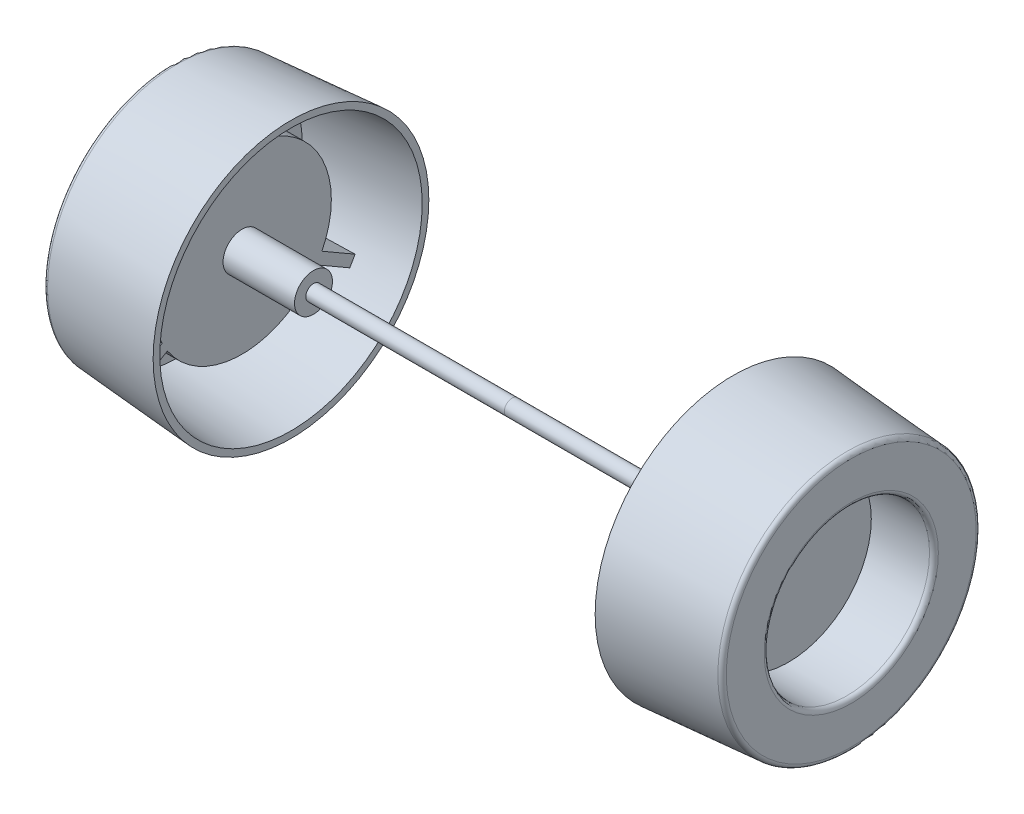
SolidWorks part; units mm, degrees
ref_plane "Alzado" through (0, 0, 0) normal (0, 0, 1) x (1, 0, 0)
ref_plane "Planta" through (0, 0, 0) normal (0, 1, 0) x (1, 0, 0)
ref_plane "Vista lateral" through (0, 0, 0) normal (1, 0, 0) x (0, 0, -1)
sketch "Croquis1" plane through (0, 0, 0) normal (1, 0, 0) x (0, 0, -1)
  circle A0 centre (0, 0) radius 29.25
ref_plane "Plano1" through (-26.8, 0, 0) normal (1, 0, 0) x (0, 0, -1)
sketch "Croquis2" plane through (-26.8, 0, 0) normal (1, 0, 0) x (0, 0, -1)
  circle A0 centre (0, 0) radius 31.25
loft "Recubrir1" add profiles "Croquis2", "Croquis1"
sketch "Croquis3" plane through (0, 0, 0) normal (1, 0, 0) x (0, 0, -1)
  circle A0 centre (0, 0) radius 18.75
extrude "Cortar-Extruir1" cut sketch "Croquis3" against normal blind 14.2
shell "Vaciado1" thickness 1.5
sketch "Croquis4" plane through (-15.7, 0, 0) normal (-1, 0, 0) x (0, 0, 1)
  line L0 (1.2023, 20.2143) -> (1.2023, 29.7215)
  line L1 (0, 0) -> (0, -6.9672) construction
  line L2 (-1.2023, 20.2143) -> (-1.2023, 29.7215)
  line L3 (16.9049, -11.1484) -> (25.1384, -15.902)
  line L4 (18.1072, -9.0659) -> (26.3408, -13.8195)
  line L5 (-18.1072, -9.0659) -> (-26.3408, -13.8195)
  line L6 (-16.9049, -11.1484) -> (-25.1384, -15.902)
  circle A0 centre (0, 0) radius 20.25 construction
  circle A1 centre (0, 0) radius 29.7458 construction
  arc A2 (1.2023, 20.2143) -> (-1.2023, 20.2143) centre (0, 0) ccw
  arc A3 (1.2023, 29.7215) -> (-1.2023, 29.7215) centre (0, 0) ccw
  arc A4 (16.9049, -11.1484) -> (18.1072, -9.0659) centre (0, 0) ccw
  arc A5 (25.1384, -15.902) -> (26.3408, -13.8195) centre (0, 0) ccw
  arc A6 (-18.1072, -9.0659) -> (-16.9049, -11.1484) centre (0, 0) ccw
  arc A7 (-26.3408, -13.8195) -> (-25.1384, -15.902) centre (0, 0) ccw
extrude "Extruir1" add sketch "Croquis4" against normal blind 8
sketch "Croquis5" plane through (-15.7, 0, 0) normal (-1, 0, 0) x (0, 0, 1)
  circle A0 centre (0, 0) radius 4.3
  circle A1 centre (0, 0) radius 1.745
extrude "Extruir2" add sketch "Croquis5" along normal blind 16.2
fillet "Redondeo1" radius 1 2 edges at (0, 0, -29.25) (0, 0, -18.75)
sketch "Croquis6" plane through (-31.9, 0, 0) normal (-1, 0, 0) x (0, 0, 1)
  circle A0 centre (0, 0) radius 1.745
extrude "Extruir3" add sketch "Croquis6" along normal blind 45
mirror "Simetría1" about plane through (-76.9, 0, 0) normal (-1, 0, 0)
